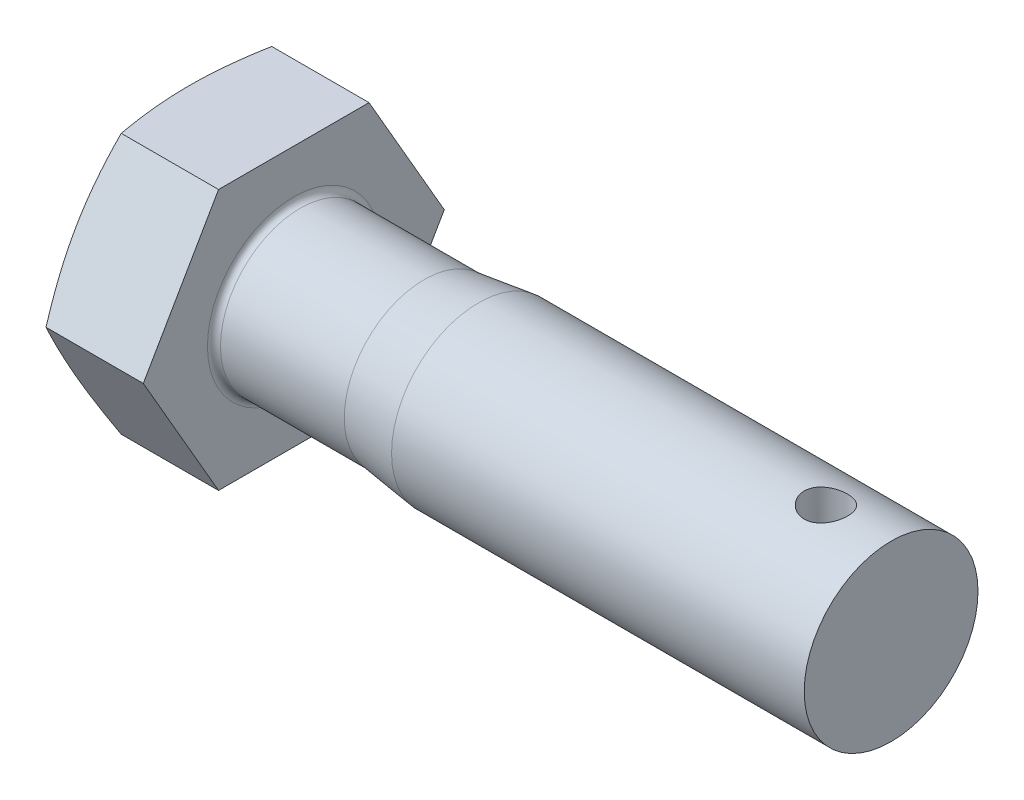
SolidWorks part; units mm, degrees
ref_plane "Front" through (0, 0, 0) normal (0, 0, 1) x (1, 0, 0)
ref_plane "Top" through (0, 0, 0) normal (0, 1, 0) x (1, 0, 0)
ref_plane "Right" through (0, 0, 0) normal (1, 0, 0) x (0, 0, -1)
sketch "Sketch1" plane through (0, 0, 0) normal (1, 0, 0) x (0, 0, -1)
  line L1 (6.9282, -12) -> (13.8564, 0)
  line L2 (13.8564, 0) -> (6.9282, 12)
  line L3 (6.9282, 12) -> (-6.9282, 12)
  line L4 (-6.9282, 12) -> (-13.8564, 0)
  line L5 (-13.8564, 0) -> (-6.9282, -12)
  line L6 (-6.9282, -12) -> (6.9282, -12)
  circle A0 centre (0, 0) radius 12 construction
  dimension "s" = 24
extrude "BaseHead" add sketch "Sketch1" along normal blind 10
ref_plane "Plane1" through (27, 0, 0) normal (1, 0, 0) x (0, 0, -1)
sketch "Sketch2" plane through (10, 0, 0) normal (1, 0, 0) x (0, 0, -1)
  circle A0 centre (0, 0) radius 8
  dimension "d" = 16
extrude "BaseBody" add sketch "Sketch2" along normal blind 55
sketch "Sketch3" plane through (3.1612, 0, 2.6123) normal (0, 1, 0) x (0, 0, -1)
  line L0 (2.6123, 2.0714) -> (2.6123, -1.5224) construction
  line L2 (16.4687, 3.1612) -> (16.4687, 2.1216)
  line L3 (16.4687, 2.1216) -> (13.6123, 3.1612)
  line L5 (13.6123, 3.1612) -> (16.4687, 3.1612)
  dimension "D1" = 20
  dimension "dw" = 22
revolve "HeadChamfer" cut sketch "Sketch3" angle 360 about L0
sketch "Sketch4" plane through (0, 0, 0) normal (1, 0, 0) x (0, 0, -1)
  circle A0 centre (0, 0) radius 8.85
  dimension "da" = 17.7
extrude "Cut-Extrude1" cut sketch "Sketch4" along normal blind 2
sketch "Sketch5" plane through (-2.9296, 0, 7.9296) normal (0, 1, 0) x (0, 0, -1)
  line L0 (7.9296, -2.9296) -> (7.9296, -19.1832) construction
  line L1 (21.786, -12.9296) -> (14.8578, -12.9296) construction
  line L2 (15.9296, -29.9296) -> (15.2801, -24.9296)
  line L3 (10.9296, -2.9296) -> (10.9296, -19.1832) construction
  line L4 (15.2801, -24.9296) -> (15.2801, -12.9296)
  line L5 (15.9296, -67.9296) -> (15.9296, -12.9296) construction
  line L6 (15.2801, -12.9296) -> (22.6306, -12.9296)
  line L7 (22.6306, -12.9296) -> (22.6306, -29.9296)
  line L8 (22.6306, -29.9296) -> (15.9296, -29.9296)
  line L9 (-0.0704, -67.9296) -> (15.9296, -67.9296) construction
  dimension "D1" = 3
  dimension "ds" = 14.701
  dimension "x" = 5
  dimension "D3" = 38
  dimension "D4" = 29.402
revolve "Cut-Revolve1" cut sketch "Sketch5" angle 360 about L0
fillet "HeadFillet" radius 0.6 1 edges at (10, 0, 7.3505)
sketch "Sketch6" plane through (0, 0, 0) normal (0, 1, 0) x (1, 0, 0)
  line L0 (10, -6.9282) -> (10, -13.8564) construction
  circle A0 centre (59, 0) radius 2
  dimension "d1" = 4
  dimension "lh" = 49
extrude "Hole" cut sketch "Sketch6" against normal through all and the other way through all
equation "\"D1@Cut-Extrude1\" = 0.2 * \"k@BaseHead\""
equation "\"b@ThreadCosmetic1\" = \"l@BaseBody\" - \"lg@Plane1\""
equation "\"D4@Sketch5\" = 2 * \"ds@Sketch5\""
equation "\"D3@Sketch5\" = \"l@BaseBody\" - \"lg@Plane1\""
